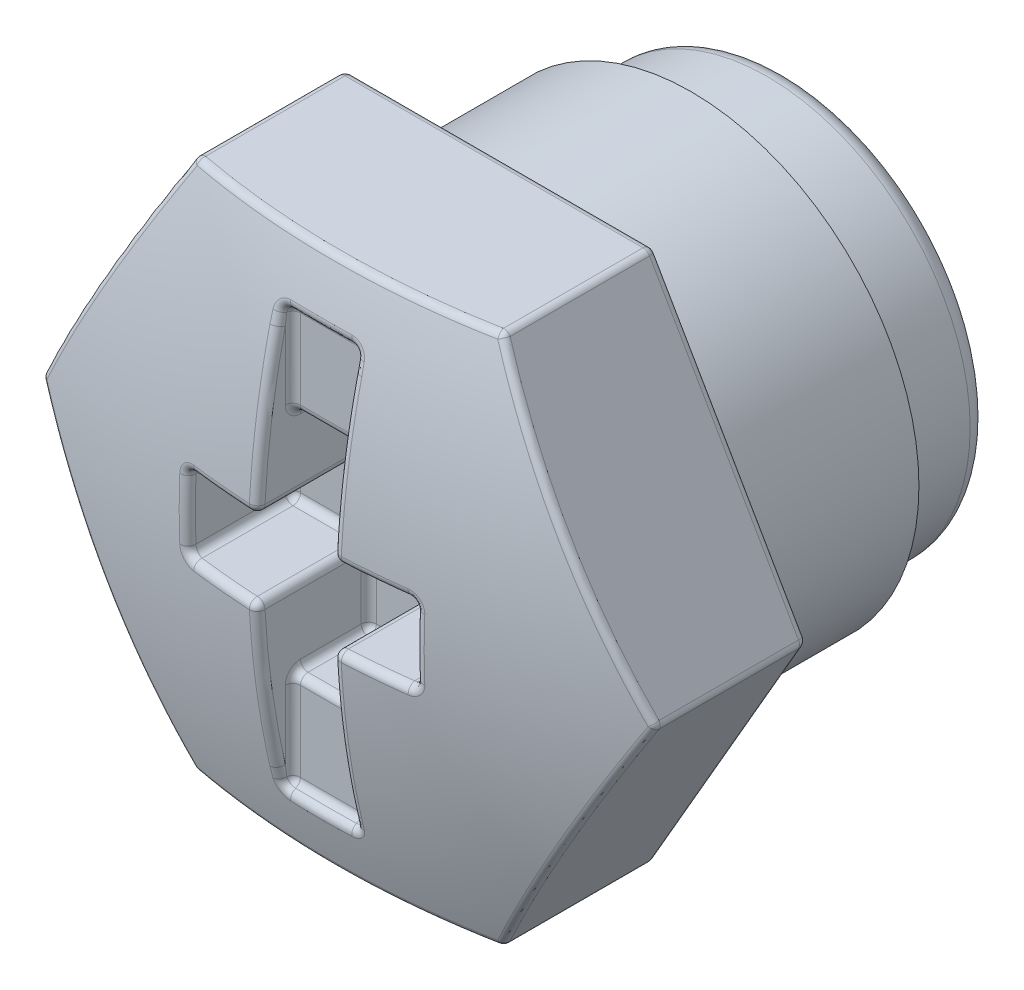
SolidWorks part; units mm, degrees
ref_plane "Face" through (0, 0, 0) normal (0, 0, 1) x (1, 0, 0)
ref_plane "Dessus" through (0, 0, 0) normal (0, 1, 0) x (1, 0, 0)
ref_plane "Droite" through (0, 0, 0) normal (1, 0, 0) x (0, 0, -1)
sketch "Esquisse1" plane through (0, 0, 0) normal (0, 0, 1) x (1, 0, 0)
  line L1 (8.0829, 0) -> (4.0415, 7)
  line L2 (4.0415, 7) -> (-4.0415, 7)
  line L3 (-4.0415, 7) -> (-8.0829, 0)
  line L4 (-8.0829, 0) -> (-4.0415, -7)
  line L5 (-4.0415, -7) -> (4.0415, -7)
  line L6 (4.0415, -7) -> (8.0829, 0)
  circle A0 centre (0, 0) radius 7 construction
  dimension "D1" = 14
extrude "Extrusion1" add sketch "Esquisse1" along normal blind 5.5
ref_plane "Plan1" through (0, 0, 5.5) normal (0, 0, 1) x (1, 0, 0)
sketch "Esquisse2" plane through (0, 0, 0) normal (0, 1, 0) x (1, 0, 0)
  line L0 (0, 0) -> (0, -6.3806) construction
  line L1 (4.0415, -5.5) -> (-4.0415, -5.5) construction
  line L2 (-8.0829, -5.5) -> (-8.0829, 0) construction
  line L3 (0, -5.5) -> (0, -6)
  line L4 (0, -6) -> (-8.0829, -6)
  line L5 (-8.0829, -4) -> (-8.0829, -6)
  arc A0 (0, -5.5) -> (-8.0829, -4) centre (0, 17.0278) cw
  dimension "D1" = 1.5
  dimension "D2" = 0.5
revolve "Enlèvement de matière-Révolution2" cut sketch "Esquisse2" angle 360 about L0
sketch "Esquisse3" plane through (0, 0, 5.5) normal (0, 0, 1) x (1, 0, 0)
  line L0 (0, 3) -> (0, -3) construction
  line L1 (3, 0) -> (-3, 0) construction
  line L2 (-1, 3) -> (1, 3)
  line L3 (1, 3) -> (1, 1)
  line L4 (1, 1) -> (3, 1)
  line L5 (3, 1) -> (3, -1)
  line L6 (1, -3) -> (1, -1)
  line L7 (-1, -3) -> (1, -3)
  line L8 (1, -1) -> (3, -1)
  line L9 (-1, -3) -> (-1, -1)
  line L10 (-1, -1) -> (-3, -1)
  line L11 (-3, 1) -> (-3, -1)
  line L12 (-1, 1) -> (-3, 1)
  line L13 (-1, 3) -> (-1, 1)
  point P19 (0, 3)
  dimension "D1" = 2
  dimension "D2" = 6
extrude "Enlèv. mat.-Extru.1" cut sketch "Esquisse3" against normal blind 3
sketch "Esquisse4" plane through (0, 0, 5.5) normal (0, 0, 1) x (1, 0, 0)
  line L0 (1, 3) -> (1, 1) construction
  line L1 (-1, 5.5) -> (1, 5.5)
  line L2 (-1, 5.5) -> (-1, -5.5)
  line L3 (-1, -5.5) -> (1, -5.5)
  line L4 (1, 5.5) -> (1, -5.5)
  line L5 (-1, 1) -> (-1, 3) construction
  line L6 (0, 0) -> (1.8147, 0) construction
  dimension "D1" = 11
extrude "Enlèv. mat.-Extru.2" cut sketch "Esquisse4" against normal blind 1
fillet "Congé3" radius 0.2 4 edges at (1, -5.5, 4.6477) (-1, -5.5, 4.6477) (1, 5.5, 4.6477) (-1, 5.5, 4.6477)
fillet "Congé1" radius 0.2 36 edges at (-1, -4.15, 4.5) (-1, 4.15, 4.5) (1, 4.15, 4.5) (1, -4.15, 4.5) (2, 1, 2.5) (3, 0, 2.5) (2, -1, 2.5) (1, -2, 2.5) (0, -3, 2.5) (-1, -2, 2.5) (-2, -1, 2.5) (-3, 0, 2.5) (-2, 1, 2.5) (-1, 2, 2.5) (0, 3, 2.5) (1, 2, 2.5) (0, -5.5, 4.5) (-1, -3, 3.5) (0, 5.5, 4.5) (-1, 3, 3.5) (1, 3, 3.5) (1, -3, 3.5) (0, 3, 4.5) (0, -3, 4.5) (3, -1, 3.8885) (3, 1, 3.8885) (-3, 1, 3.8885) (-3, -1, 3.8885) (-1, -1, 3.9778) (1, -1, 3.9778) (1, 1, 3.9778) (-1, 1, 3.9778) (-0.9414, -5.4414, 4.5) (0.9414, -5.4414, 4.5) (0.9414, 5.4414, 4.5) (-0.9414, 5.4414, 4.5)
fillet "Congé2" radius 0.2 24 edges at (-1, -3.2639, 5.2399) (-1.0437, -1.0752, 5.4501) (-2.0013, -1, 5.3886) (-2.9254, -0.9558, 5.2888) (-3, 0, 5.2994) (-2.9569, 0.9241, 5.286) (-2.0013, 1, 5.3886) (-1.0752, 1.0437, 5.4501) (-1, 3.2639, 5.2399) (1, -3.2639, 5.2399) (1.0752, -1.0437, 5.4501) (2.0013, -1, 5.3886) (2.9569, -0.9241, 5.286) (3, 0, 5.2994) (2.9254, 0.9558, 5.2888) (2.0013, 1, 5.3886) (1.0437, 1.0752, 5.4501) (1, 3.2639, 5.2399) (0.922, 5.4585, 4.8092) (0, 5.5, 4.8183) (-0.9543, 5.4273, 4.8156) (-0.922, -5.4585, 4.8092) (0, -5.5, 4.8183) (0.9543, -5.4273, 4.8156)
fillet "Congé4" radius 0.2 18 edges at (0, -7, 0) (0, -7, 4.3849) (-6.0622, -3.5, 0) (-6.0622, -3.5, 4.3849) (-4.0415, -7, 2) (-6.0622, 3.5, 0) (-6.0622, 3.5, 4.3849) (-8.0829, 0, 2) (0, 7, 0) (0, 7, 4.3849) (-4.0415, 7, 2) (6.0622, 3.5, 0) (6.0622, 3.5, 4.3849) (4.0415, 7, 2) (6.0622, -3.5, 0) (4.0415, -7, 2) (6.0622, -3.5, 4.3849) (8.0829, 0, 2)
sketch "Esquisse5" plane through (0, 0, 0) normal (0, 0, -1) x (-1, 0, 0)
  circle A0 centre (0, 0) radius 6
  dimension "D1" = 12
extrude "Extrusion2" add sketch "Esquisse5" along normal blind 5
sketch "Esquisse6" plane through (0, 0, -5) normal (0, 0, -1) x (-1, 0, 0)
  circle A0 centre (0, 0) radius 5.35
  dimension "D1" = 10.7
extrude "Extrusion3" add sketch "Esquisse6" along normal blind 2.5
sketch "Esquisse7" plane through (0, 0, -7.5) normal (0, 0, -1) x (-1, 0, 0)
  circle A0 centre (0, 0) radius 4.15
  circle A1 centre (0, 0) radius 5.35
  circle A2 centre (0, 0) radius 5.35 construction
  dimension "D1" = 0
  dimension "D2" = 1.2
extrude "Enlèv. mat.-Extru.3" cut sketch "Esquisse7" against normal blind 9
fillet "Congé5" radius 0.5 1 edges at (-5.35, 0, -7.5)
